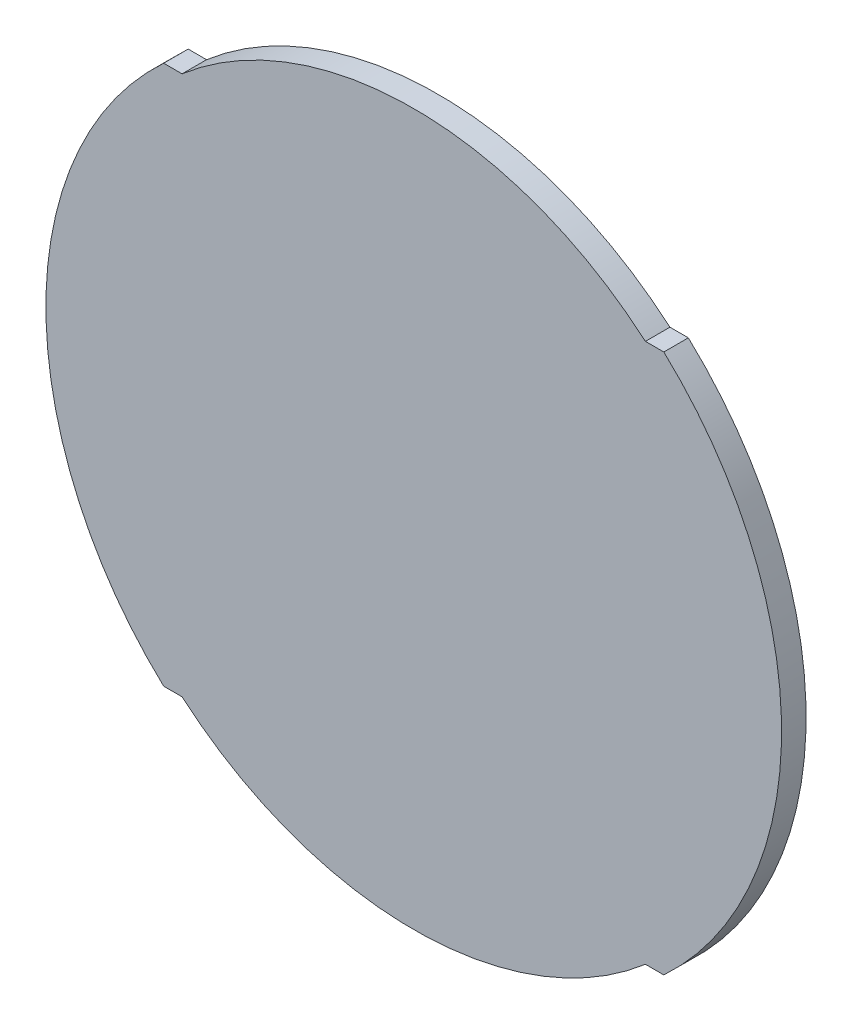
SolidWorks part; units mm, degrees
ref_plane "Plan1" through (0, 0, 0) normal (0, 0, 1) x (1, 0, 0)
ref_plane "Plan2" through (0, 0, 0) normal (0, 1, 0) x (1, 0, 0)
ref_plane "Plan3" through (0, 0, 0) normal (1, 0, 0) x (0, 0, -1)
sketch "Esquisse2" plane through (0, 0, 0) normal (0, 0, 1) x (1, 0, 0)
  line L0 (-15.2971, 16.5) -> (-14.1708, 16.5)
  line L1 (-15.2971, -16.5) -> (-14.1708, -16.5)
  line L2 (14.1708, -16.5) -> (15.2971, -16.5)
  line L3 (14.1708, 16.5) -> (15.2971, 16.5)
  arc A0 (-15.2971, 16.5) -> (-15.2971, -16.5) centre (0, 0) ccw
  arc A1 (14.1708, 16.5) -> (-14.1708, 16.5) centre (0, 0) ccw
  arc A2 (15.2971, -16.5) -> (15.2971, 16.5) centre (0, 0) ccw
  arc A3 (-14.1708, -16.5) -> (14.1708, -16.5) centre (0, 0) ccw
  dimension "D1" = 45
  dimension "D2" = 43.5
  dimension "D3" = 16.5
  dimension "D4" = 33
extrude "Base-Extrusion" add sketch "Esquisse2" along normal blind 1.5
